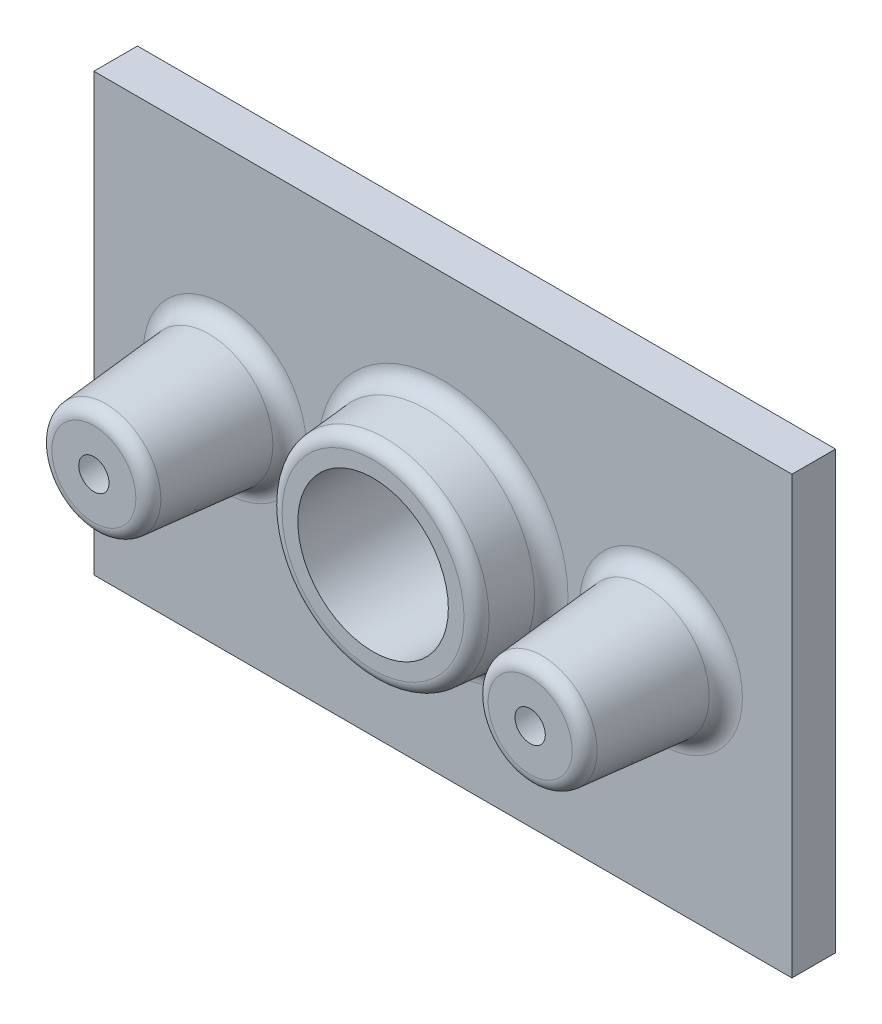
SolidWorks part; units mm, degrees
ref_plane "Plan de face" through (0, 0, 0) normal (0, 0, 1) x (1, 0, 0)
ref_plane "Plan de dessus" through (0, 0, 0) normal (0, 1, 0) x (1, 0, 0)
ref_plane "Plan de droite" through (0, 0, 0) normal (1, 0, 0) x (0, 0, -1)
sketch "Esquisse1" plane through (0, 0, 0) normal (0, 0, 1) x (1, 0, 0)
  line L0 (-40, 25) -> (40, -25) construction
  line L1 (-40, 25) -> (40, 25)
  line L2 (-40, 25) -> (-40, -25)
  line L3 (-40, -25) -> (40, -25)
  line L4 (40, 25) -> (40, -25)
  dimension "D1" = 80
  dimension "D2" = 50
extrude "Extrusion1" add sketch "Esquisse1" along normal blind 5
sketch "Esquisse2" plane through (0, 0, 5) normal (0, 0, 1) x (1, 0, 0)
  circle A0 centre (0, 0) radius 12.5
  dimension "D1" = 25
extrude "Extrusion2" add sketch "Esquisse2" along normal blind 8 draft 5
sketch "Esquisse4" plane through (0, 0, 0) normal (0, 0, -1) x (-1, 0, 0)
  line L0 (-28.2, 7.3321) -> (-7.2, 16.4973)
  line L1 (7.2, 16.4973) -> (28.2, 7.3321)
  line L2 (7.2, -16.4973) -> (28.2, -7.3321)
  line L3 (-28.2, -7.3321) -> (-7.2, -16.4973)
  arc A0 (7.2, 16.4973) -> (-7.2, 16.4973) centre (0, 0) ccw
  arc A1 (-7.2, -16.4973) -> (7.2, -16.4973) centre (0, 0) ccw
  arc A3 (-28.2, 7.3321) -> (-28.2, -7.3321) centre (-25, 0) ccw
  arc A4 (28.2, -7.3321) -> (28.2, 7.3321) centre (25, 0) ccw
  dimension "D1" = 36
  dimension "D2" = 16
  dimension "D3" = 16
  dimension "D4" = 25
  dimension "D5" = 25
extrude "Extrusion3" add sketch "Esquisse4" along normal blind 3 draft 3
sketch "Esquisse11" plane through (0, 0, -3) normal (0, 0, -1) x (-1, 0, 0)
  line L2 (-23.5339, 9.197) -> (-28.1371, 7.188)
  line L3 (-28.1371, -7.188) -> (-23.5339, -9.197)
  line L4 (-23.5339, -9.197) -> (-19.1041, -3.7847)
  line L5 (-19.1041, -3.7847) -> (-19.1041, 3.7847)
  line L6 (-19.1041, 3.7847) -> (-23.5339, 9.197)
  line L7 (-25, 0) -> (0, 0) construction
  arc A1 (-28.1371, 7.188) -> (-28.1371, -7.188) centre (-25, 0) ccw
extrude "Boss.-Extru.2" add sketch "Esquisse11" along normal blind 3
mirror "Symétrie1" about plane through (0, 0, 0) normal (1, 0, 0) of "Boss.-Extru.2"
sketch "Esquisse3" plane through (0, 0, 13) normal (0, 0, 1) x (1, 0, 0)
  circle A0 centre (0, 0) radius 8.625
  dimension "D1" = 17.25
extrude "Enlèv. mat.-Extru.1" cut sketch "Esquisse3" against normal through all
sketch "Esquisse5" plane through (0, 0, 5) normal (0, 0, 1) x (1, 0, 0)
  circle A0 centre (-25, 0) radius 7.5
  circle A1 centre (25, 0) radius 7.5
  arc A2 (28.2, -7.3321) -> (28.2, 7.3321) centre (25, 0) ccw construction
  arc A3 (-28.2, 7.3321) -> (-28.2, -7.3321) centre (-25, 0) ccw construction
  dimension "D1" = 15
  dimension "D2" = 15
extrude "Extrusion4" add sketch "Esquisse5" along normal blind 15 draft 5
fillet "Congé1" radius 2 3 edges at (32.5, 0, 5) (12.5, 0, 5) (-17.5, 0, 5)
fillet "Congé2" radius 1.5 3 edges at (31.1877, 0, 20) (11.8001, 0, 13) (-18.8123, 0, 20)
fillet "Congé3" radius 2 8 edges at (-33, 0, 0) (-17.7, -11.9147, 0) (0, -18, 0) (17.7, -11.9147, 0) (33, 0, 0) (17.7, 11.9147, 0) (0, 18, 0) (-17.7, 11.9147, 0)
chamfer "Chanfrein1" distance 0.5 angle 45 1 edges at (-8.625, 0, -3)
hole_wizard "Trou taraudé M81" positions "Esquisse13" profile "Esquisse12" tap size "M8" standard "Iso"
sketch "Esquisse13" plane through (0, 0, -6) normal (0, 0, -1) x (-1, 0, 0)
  circle A0 centre (-25, 0) radius 4.8132 construction
  point P0 (-25, 0)
sketch "Esquisse12" plane through (25, 0, -6) normal (1, 0, 0) x (0, 1, 0)
  line L0 (0, 0) -> (0, 27.0429)
  line L1 (0, 27.0429) -> (3.4, 25)
  line L2 (3.4, 25) -> (3.4, 0)
  line L5 (3.4, 0) -> (0, 0)
  line L10 (0, 27.0429) -> (-3.4, 25) construction
  line L11 (0, -6.35) -> (0, 107.95) construction
  dimension "Diamètre du trou pour taraudage" = 6.8
  dimension "Profondeur du trou pour taraudage" = 25
  dimension "Angle de pointe" = 118
mirror "Symétrie2" about plane through (0, 0, 0) normal (1, 0, 0) of "Trou taraudé M81"
